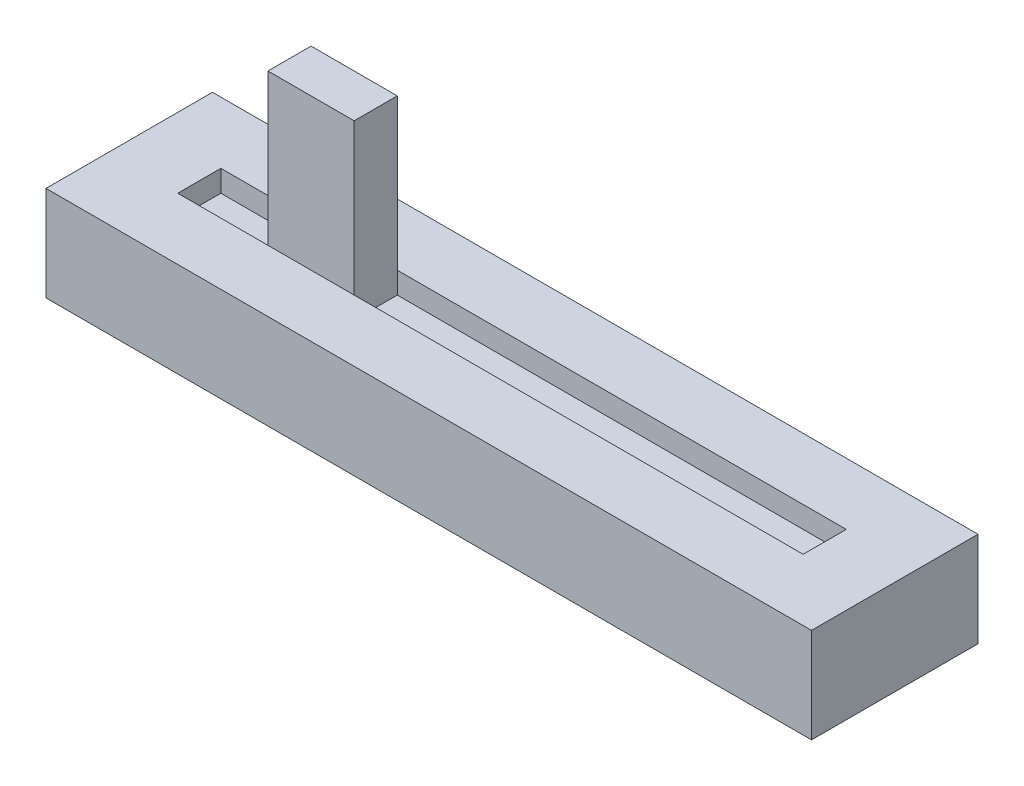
SolidWorks part; units mm, degrees
ref_plane "Front Plane" through (0, 0, 0) normal (0, 0, 1) x (1, 0, 0)
ref_plane "Top Plane" through (0, 0, 0) normal (0, 1, 0) x (1, 0, 0)
ref_plane "Right Plane" through (0, 0, 0) normal (1, 0, 0) x (0, 0, -1)
sketch "Sketch1" plane through (0, 0, 0) normal (0, 1, 0) x (1, 0, 0)
  line L1 (22.5425, -4.9022) -> (-22.5425, -4.9022)
  line L2 (22.5425, -4.9022) -> (22.5425, 4.9022)
  line L3 (22.5425, 4.9022) -> (-22.5425, 4.9022)
  line L4 (-22.5425, -4.9022) -> (-22.5425, 4.9022)
  line L5 (22.5425, -4.9022) -> (-22.5425, 4.9022) construction
  line L6 (22.5425, 4.9022) -> (-22.5425, -4.9022) construction
  point P0 (0, 0)
  dimension "D1" = 45.085
  dimension "D2" = 9.8044
extrude "Boss-Extrude1" add sketch "Sketch1" along normal blind 5.588
sketch "Sketch2" plane through (0, 5.588, 0) normal (0, 1, 0) x (1, 0, 0)
  line L1 (18.415, -1.27) -> (-18.415, -1.27)
  line L2 (18.415, -1.27) -> (18.415, 1.27)
  line L3 (18.415, 1.27) -> (-18.415, 1.27)
  line L4 (-18.415, -1.27) -> (-18.415, 1.27)
  line L5 (18.415, -1.27) -> (-18.415, 1.27) construction
  line L6 (18.415, 1.27) -> (-18.415, -1.27) construction
  point P0 (0, 0)
  dimension "D1" = 2.54
  dimension "D2" = 36.83
extrude "Cut-Extrude1" cut sketch "Sketch2" against normal blind 1.27
sketch "Sketch3" plane through (0, 4.318, 0) normal (0, 1, 0) x (1, 0, 0)
  line L0 (-18.415, -1.27) -> (18.415, -1.27) construction
  line L1 (-13.1058, 1.27) -> (-8.0258, 1.27)
  line L2 (-13.1058, 1.27) -> (-13.1058, -1.27)
  line L3 (-13.1058, -1.27) -> (-8.0258, -1.27)
  line L4 (-8.0258, 1.27) -> (-8.0258, -1.27)
  line L5 (-13.1058, 1.27) -> (-8.0258, -1.27) construction
  line L6 (-13.1058, -1.27) -> (-8.0258, 1.27) construction
  line L8 (18.415, 1.27) -> (-18.415, 1.27) construction
  point P0 (-10.5658, 0)
  dimension "D1" = 5.08
extrude "Boss-Extrude2" add sketch "Sketch3" along normal blind 10.16
sketch "Sketch6" plane through (0, 0, 0) normal (0, -1, 0) x (1, 0, 0)
  line L0 (22.5425, 4.9022) -> (22.5425, -4.9022) construction
  line L1 (-22.5425, -1.651) -> (-21.7805, -1.651)
  line L2 (-22.5425, -1.651) -> (-22.5425, -2.413)
  line L3 (-22.5425, -2.413) -> (-21.7805, -2.413)
  line L4 (-21.7805, -1.651) -> (-21.7805, -2.413)
  line L5 (-22.5425, -1.651) -> (-21.7805, -2.413) construction
  line L6 (-22.5425, -2.413) -> (-21.7805, -1.651) construction
  line L7 (21.7805, -1.651) -> (22.5425, -1.651)
  line L8 (21.7805, -1.651) -> (21.7805, -2.413)
  line L9 (21.7805, -2.413) -> (22.5425, -2.413)
  line L10 (22.5425, -1.651) -> (22.5425, -2.413)
  line L11 (21.7805, -1.651) -> (22.5425, -2.413) construction
  line L12 (21.7805, -2.413) -> (22.5425, -1.651) construction
  line L13 (21.7805, 2.413) -> (22.5425, 2.413)
  line L14 (21.7805, 2.413) -> (21.7805, 1.651)
  line L15 (21.7805, 1.651) -> (22.5425, 1.651)
  line L16 (22.5425, 2.413) -> (22.5425, 1.651)
  line L17 (21.7805, 2.413) -> (22.5425, 1.651) construction
  line L18 (21.7805, 1.651) -> (22.5425, 2.413) construction
  line L19 (-22.5425, -4.9022) -> (-22.5425, 4.9022) construction
  line L20 (22.5425, 0) -> (0, 0) construction
  point P0 (-22.1615, -2.032)
  point P5 (22.1615, -2.032)
  point P10 (22.1615, 2.032)
  dimension "D1" = 4.064
  dimension "D2" = 0.762
  dimension "D3" = 0.762
